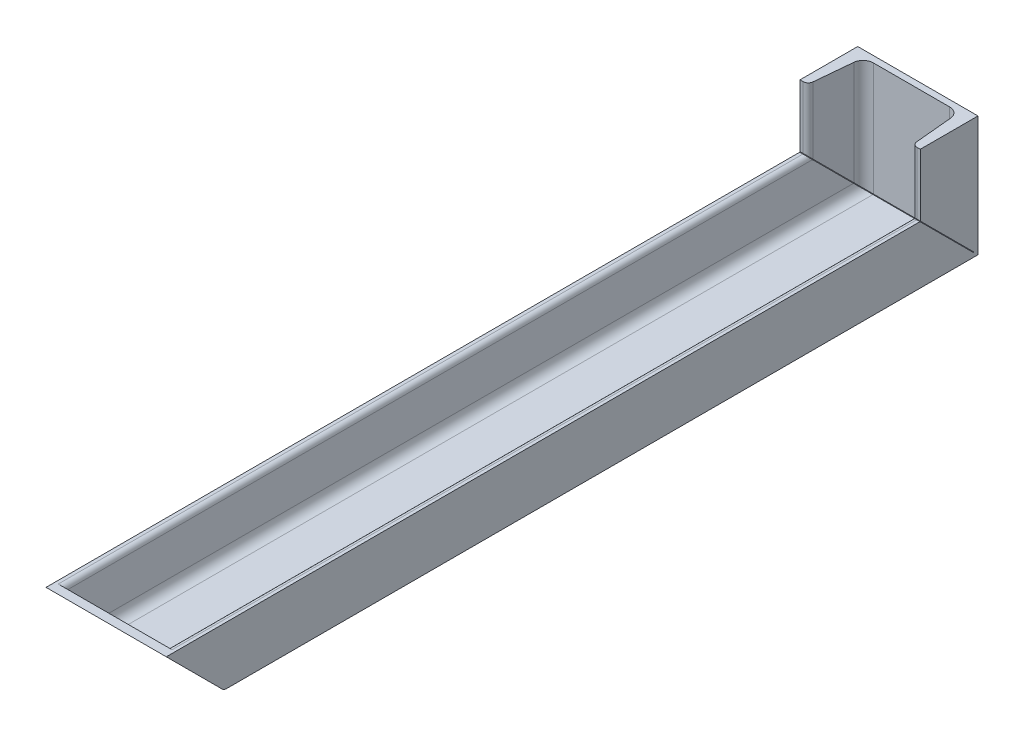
SolidWorks part; units mm, degrees
ref_plane "前视基准面" through (0, 0, 0) normal (0, 0, 1) x (1, 0, 0)
ref_plane "上视基准面" through (0, 0, 0) normal (0, 1, 0) x (1, 0, 0)
ref_plane "右视基准面" through (0, 0, 0) normal (1, 0, 0) x (0, 0, -1)
sketch "草图1" plane through (0, 0, 0) normal (0, 0, 1) x (1, 0, 0)
  line L0 (-50, 0) -> (50, 0)
  line L1 (50, 0) -> (50, 48)
  line L2 (50, 48) -> (47.3249, 48)
  line L3 (43.1433, 44.1917) -> (40.222, 13.0072)
  line L4 (31.759, 5.3) -> (-31.759, 5.3)
  line L5 (-40.222, 13.0072) -> (-43.1433, 44.1917)
  line L6 (-47.3249, 48) -> (-50, 48)
  line L7 (-50, 48) -> (-50, 0)
  line L8 (-50, 26.65) -> (-41.5, 26.65) construction
  line L9 (41.5, 26.65) -> (50, 26.65) construction
  arc A0 (-31.759, 5.3) -> (-40.222, 13.0072) centre (-31.759, 13.8) cw
  arc A1 (40.222, 13.0072) -> (31.759, 5.3) centre (31.759, 13.8) cw
  arc A2 (-43.1433, 44.1917) -> (-47.3249, 48) centre (-47.3249, 43.8) ccw
  arc A3 (47.3249, 48) -> (43.1433, 44.1917) centre (47.3249, 43.8) ccw
  point P19 (-43.5, 48)
  point P22 (43.5, 48)
  dimension "D11" = 8.5
  dimension "D12" = 4.2
  dimension "D1" = 100
  dimension "D2" = 48
  dimension "D3" = 48
  dimension "D4" = 50
  dimension "D5" = 5.3
  dimension "D6" = 21.35
  dimension "D7" = 8.5
  dimension "D8" = 6.5
  dimension "D9" = 6.5
  dimension "D10" = 8.5
extrude "拉伸1" add sketch "草图1" along normal blind 667.5
sketch "草图3" plane through (0, 0, 0) normal (0, -1, 0) x (1, 0, 0)
  line L0 (-50, 0) -> (50, 0)
  line L1 (50, 0) -> (50, 48)
  line L2 (50, 667.5) -> (50, 0) construction
  line L3 (50, 48) -> (47.3249, 48)
  line L4 (43.1433, 44.1917) -> (40.222, 13.0072)
  line L5 (31.759, 5.3) -> (-31.759, 5.3)
  line L6 (-40.222, 13.0072) -> (-43.1433, 44.1917)
  line L7 (-47.3249, 48) -> (-50, 48)
  line L8 (-50, 667.5) -> (-50, 0) construction
  line L9 (-50, 48) -> (-50, 0)
  line L10 (-50, 26.65) -> (-41.5, 26.65) construction
  line L11 (41.5, 26.65) -> (50, 26.65) construction
  arc A0 (-43.1433, 44.1917) -> (-47.3249, 48) centre (-47.3249, 43.8) ccw
  arc A1 (47.3249, 48) -> (43.1433, 44.1917) centre (47.3249, 43.8) ccw
  arc A2 (-31.759, 5.3) -> (-40.222, 13.0072) centre (-31.759, 13.8) cw
  arc A3 (40.222, 13.0072) -> (31.759, 5.3) centre (31.759, 13.8) cw
  point P20 (-43.5, 48)
  point P23 (43.5, 48)
  dimension "D9" = 4.2
  dimension "D10" = 8.5
  dimension "D1" = 6.5
  dimension "D2" = 6.5
  dimension "D3" = 48
  dimension "D4" = 48
  dimension "D5" = 5.3
  dimension "D6" = 21.35
  dimension "D7" = 8.5
  dimension "D8" = 8.5
extrude "拉伸2" add sketch "草图3" against normal blind 100
sketch "草图4" plane through (-50, 0, 0) normal (-1, 0, 0) x (0, 0, 1)
  line L0 (0, 0) -> (48, 48) construction
  line L1 (50.1113, 50.3941) -> (3.6062, 3.8891)
  line L2 (3.6062, 3.8891) -> (3.8891, 3.6062)
  line L3 (3.8891, 3.6062) -> (50.3941, 50.1113)
  line L4 (50.3941, 50.1113) -> (50.1113, 50.3941)
  line L5 (667.5, 48) -> (667.5, 0)
  line L6 (667.5, 0) -> (619.5, 0)
  line L7 (667.5, 0) -> (0, 0) construction
  line L8 (619.5, 0) -> (667.5, 48)
  dimension "D1" = 0.2
  dimension "D2" = 0.4
  dimension "D3" = 5.3
  dimension "D4" = 45
extrude "切除-拉伸1" cut sketch "草图4" against normal blind 100
sketch "草图5" plane through (-50, 0, 0) normal (-1, 0, 0) x (0, 0, 1)
  line L0 (619.5, 0) -> (667.5, 48)
  line L1 (667.5, 48) -> (674.9953, 48)
  line L2 (674.9953, 48) -> (626.9953, 0)
  line L3 (619.5, 0) -> (626.9953, 0)
  dimension "D1" = 5.3
extrude "拉伸3" add sketch "草图5" against normal blind 100
fillet "圆角1" radius 5 1 edges at (0, 0, 626.9953)
